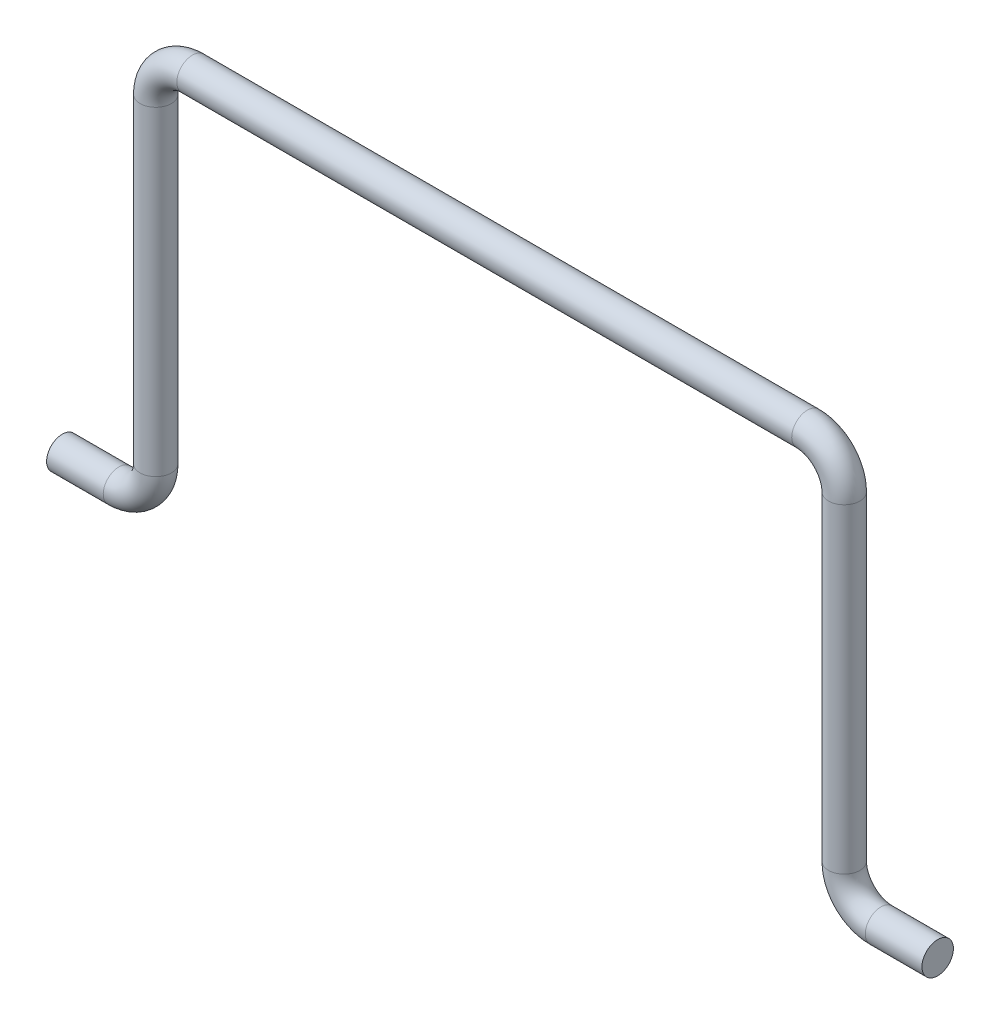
SolidWorks part; units mm, degrees
ref_plane "Plane1" through (0, 0, 0) normal (0, 0, 1) x (1, 0, 0)
ref_plane "Plane2" through (0, 0, 0) normal (0, 1, 0) x (1, 0, 0)
ref_plane "Plane3" through (0, 0, 0) normal (1, 0, 0) x (0, 0, -1)
sketch "Sketch1" plane through (0, 0, 0) normal (0, 0, 1) x (1, 0, 0)
  line L0 (0, 0) -> (0, -37.386) construction
  line L1 (-56.515, 0) -> (-49.1998, 0)
  line L2 (-44.45, 4.7498) -> (-44.45, 46.0502)
  line L3 (-39.7002, 50.8) -> (39.7002, 50.8)
  line L4 (44.45, 4.7498) -> (44.45, 46.0502)
  line L5 (56.515, 0) -> (49.1998, 0)
  arc A0 (-39.7002, 50.8) -> (-44.45, 46.0502) centre (-39.7002, 46.0502) ccw
  arc A1 (-44.45, 4.7498) -> (-49.1998, 0) centre (-49.1998, 4.7498) cw
  arc A2 (44.45, 4.7498) -> (49.1998, 0) centre (49.1998, 4.7498) ccw
  arc A3 (39.7002, 50.8) -> (44.45, 46.0502) centre (39.7002, 46.0502) cw
  dimension "D1" = 4.7498
  dimension "D3" = 88.9
  dimension "D2" = 50.8
  dimension "D4" = 12.065
  dimension "D5" = 7.3152
  dimension "D6" = 98.3996
ref_plane "Plane4" through (56.515, 0, 0) normal (1, 0, 0) x (0, 0, -1)
sketch "Sketch2" plane through (56.515, 0, 0) normal (1, 0, 0) x (0, 0, -1)
  circle A0 centre (0, 0) radius 2.032
  dimension "D1" = 4.064
sweep "Base-Sweep" add profiles "Sketch2" path "Sketch1"
